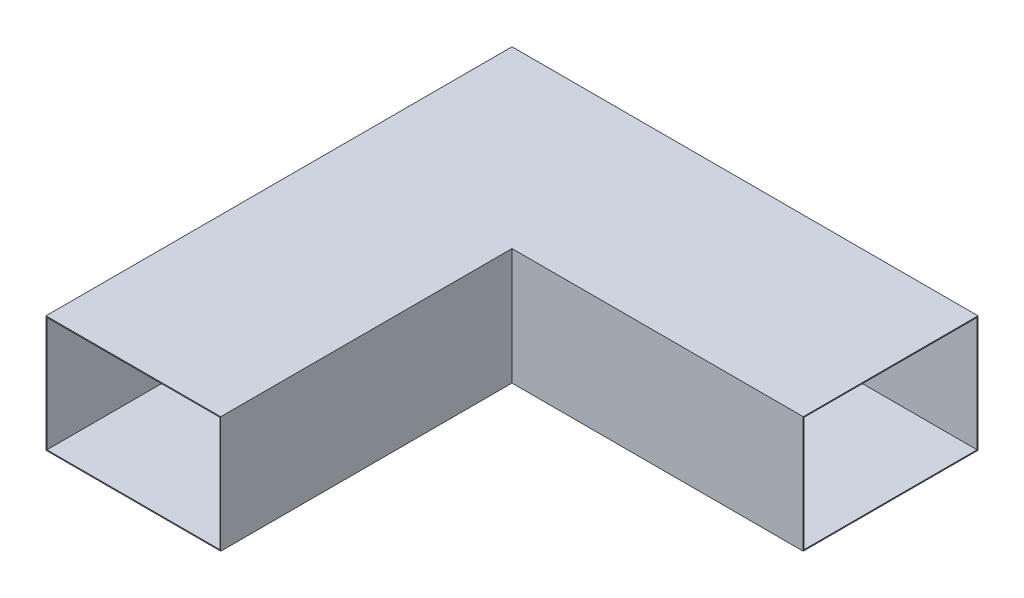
SolidWorks part; units mm, degrees
ref_plane "Front Plane" through (0, 0, 0) normal (0, 0, 1) x (1, 0, 0)
ref_plane "Top Plane" through (0, 0, 0) normal (0, 1, 0) x (1, 0, 0)
ref_plane "Right Plane" through (0, 0, 0) normal (1, 0, 0) x (0, 0, -1)
sketch "Sketch1" plane through (0, 0, 0) normal (0, 1, 0) x (1, 0, 0)
  line L1 (-609.6, 609.6) -> (609.6, 609.6)
  line L2 (-609.6, 609.6) -> (-609.6, -609.6)
  line L3 (-609.6, -609.6) -> (609.6, -609.6)
  line L4 (609.6, 609.6) -> (609.6, -609.6)
  dimension "D1" = 1219.2
  dimension "D2" = 1219.2
  dimension "D3" = 609.6
  dimension "D4" = 609.6
extrude "Boss-Extrude1" add sketch "Sketch1" along normal blind 304.8
sketch "Sketch2" plane through (0, 304.8, 0) normal (0, 1, 0) x (1, 0, 0)
  line L1 (-152.4, 152.4) -> (609.6, 152.4)
  line L2 (-152.4, 152.4) -> (-152.4, -609.6)
  line L3 (-152.4, -609.6) -> (609.6, -609.6)
  line L4 (609.6, 152.4) -> (609.6, -609.6)
  dimension "D1" = 762
extrude "Cut-Extrude1" cut sketch "Sketch2" against normal blind 304.8
shell "Shell1" thickness 2.54
